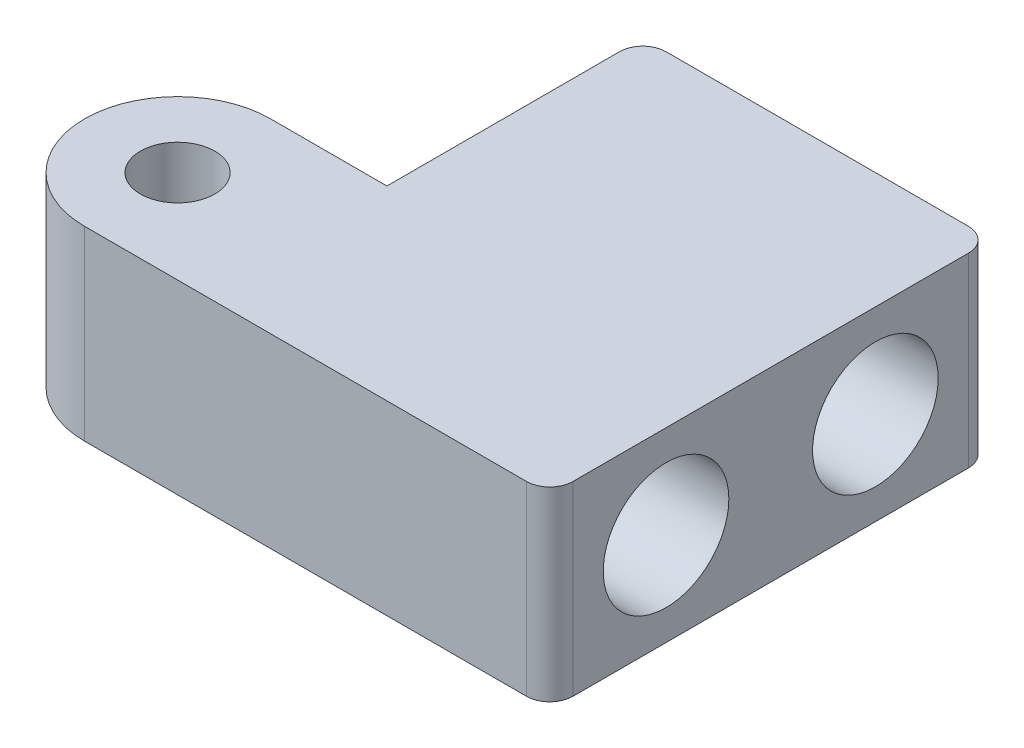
SolidWorks part; units mm, degrees
ref_plane "Front" through (0, 0, 0) normal (0, 0, 1) x (1, 0, 0)
ref_plane "Top" through (0, 0, 0) normal (0, 1, 0) x (1, 0, 0)
ref_plane "Right" through (0, 0, 0) normal (1, 0, 0) x (0, 0, -1)
sketch "草图1" plane through (0, 0, 0) normal (0, 1, 0) x (1, 0, 0)
  line L0 (0, 0) -> (20, 0)
  line L1 (0, -4) -> (20, -4)
  line L2 (5, 15) -> (20, 15)
  line L3 (20, 15) -> (20, -4)
  line L5 (5, 15) -> (5, 4)
  line L6 (5, 4) -> (0, 4)
  line L7 (0, 15) -> (20, 15) construction
  circle A0 centre (0, 0) radius 1.6
  circle A1 centre (0, 0) radius 4
  dimension "D3" = 3.2
  dimension "D4" = 8
  dimension "D5" = 20
  dimension "D6" = 5
  dimension "D1" = 4
  dimension "D2" = 15
extrude "凸台-拉伸1" add sketch "草图1" along normal blind 8
sketch "草图2" plane through (20, 0, 0) normal (1, 0, 0) x (0, 0, -1)
  line L0 (15, 0) -> (-4, 0) construction
  line L1 (-4, 8) -> (-4, 0) construction
  line L2 (15, 8) -> (15, 0) construction
  circle A0 centre (10, 4) radius 2.7
  circle A1 centre (1, 4) radius 2.7
  dimension "D1" = 4
  dimension "D5" = 5.4
  dimension "D6" = 5.4
  dimension "D2" = 4
  dimension "D3" = 5
  dimension "D4" = 5
extrude "切除-拉伸1" cut sketch "草图2" against normal blind 10
fillet "圆角1" radius 1 3 edges at (20, 4, 4) (20, 4, -15) (5, 4, -15)
